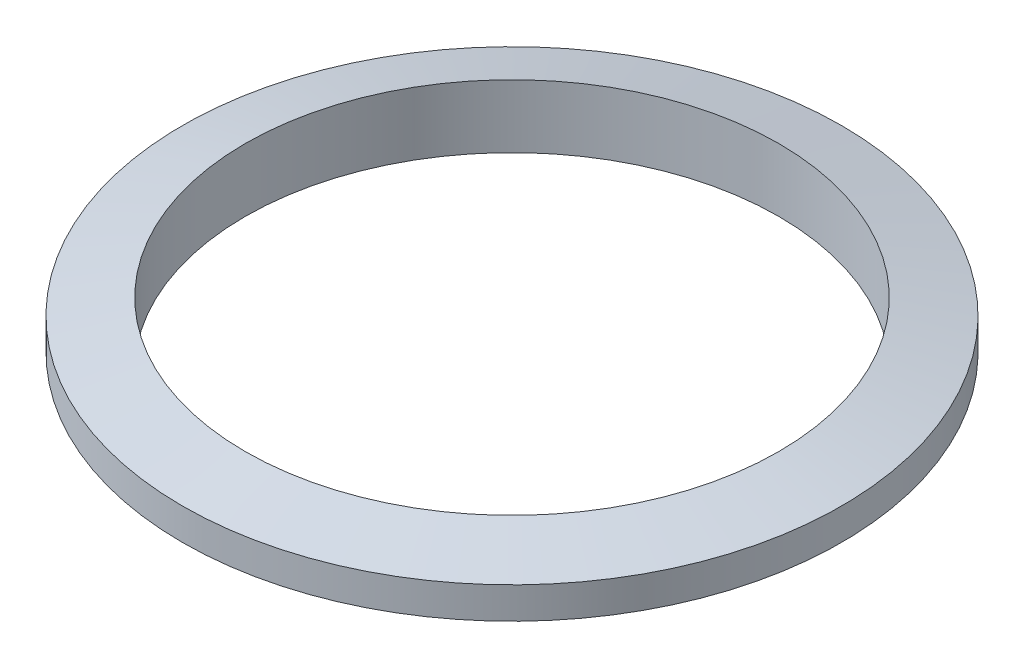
SolidWorks part; units mm, degrees
ref_plane "前视基准面" through (0, 0, 0) normal (0, 0, 1) x (1, 0, 0)
ref_plane "上视基准面" through (0, 0, 0) normal (0, 1, 0) x (1, 0, 0)
ref_plane "右视基准面" through (0, 0, 0) normal (1, 0, 0) x (0, 0, -1)
sketch "草图1" plane through (0, 0, 0) normal (0, 0, 1) x (1, 0, 0)
  line L0 (-3, -69) -> (-3, -50.6898) construction
  line L1 (-11.4493, -65) -> (-11.4493, -67) construction
  line L2 (-11.4493, -67) -> (-13.4373, -66.5) construction
  line L3 (-13.4373, -66.5) -> (-13.4373, -65.5) construction
  line L4 (-11.4493, -65) -> (-13.4373, -65.5) construction
  line L5 (-3, -69) -> (-3, -50.6898) construction
  line L6 (-11.4493, -65) -> (-11.4493, -67)
  line L7 (-11.4493, -67) -> (-13.4373, -66.5)
  line L8 (-13.4373, -66.5) -> (-13.4373, -65.5)
  line L9 (-11.4493, -65) -> (-13.4373, -65.5)
revolve "旋转1" add sketch "草图1" angle 360 about L5
